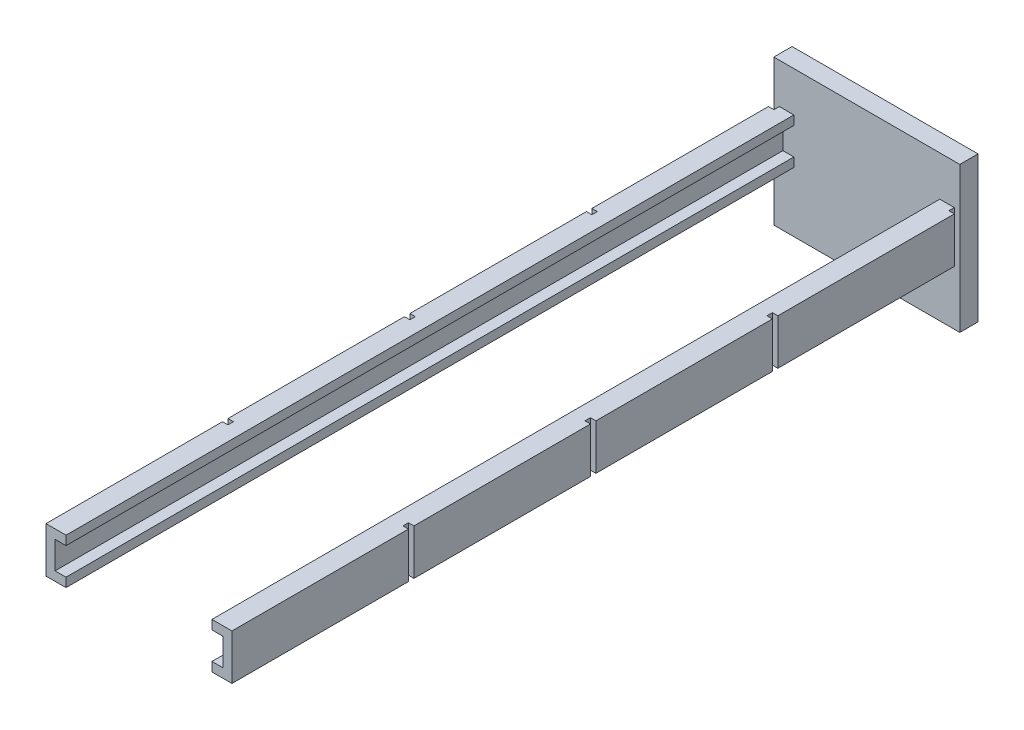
SolidWorks part; units mm, degrees
ref_plane "Plan de face" through (0, 0, 0) normal (0, 0, 1) x (1, 0, 0)
ref_plane "Plan de dessus" through (0, 0, 0) normal (0, 1, 0) x (1, 0, 0)
ref_plane "Plan de droite" through (0, 0, 0) normal (1, 0, 0) x (0, 0, -1)
sketch "Esquisse1" plane through (0, 0, 0) normal (0, 0, 1) x (1, 0, 0)
  line L0 (-40.1, -7.5) -> (-40.1, -12.5)
  line L1 (-40.1, 12.5) -> (-51.1, 12.5)
  line L2 (-40.1, 12.5) -> (-40.1, 7.5)
  line L3 (-40.1, -12.5) -> (-51.1, -12.5)
  line L4 (-51.1, 12.5) -> (-51.1, -12.5)
  line L5 (-40.1, -7.5) -> (-46.1, -7.5)
  line L6 (0, 0) -> (0, 26.5294) construction
  line L7 (-40.1, 7.5) -> (-46.1, 7.5)
  line L8 (-46.1, -7.5) -> (-46.1, 7.5)
  line L9 (51.1, 12.5) -> (51.1, -12.5)
  line L10 (40.1, 12.5) -> (51.1, 12.5)
  line L11 (40.1, 12.5) -> (40.1, 7.5)
  line L12 (40.1, 7.5) -> (46.1, 7.5)
  line L13 (46.1, -7.5) -> (46.1, 7.5)
  line L14 (40.1, -7.5) -> (46.1, -7.5)
  line L15 (40.1, -7.5) -> (40.1, -12.5)
  line L16 (40.1, -12.5) -> (51.1, -12.5)
  dimension "D1" = 6
  dimension "D2" = 15
  dimension "D3" = 5
  dimension "D4" = 5
  dimension "D5" = 5
  dimension "D6" = 7.5
  dimension "D7" = 40.1
extrude "Boss.-Extru.1" add sketch "Esquisse1" along normal blind 400
sketch "Esquisse2" plane through (0, 0, 0) normal (0, 0, -1) x (-1, 0, 0)
  line L0 (51.1, 12.5) -> (51.1, -12.5) construction
  line L1 (-51.1, 34.5585) -> (51.1, 34.5585)
  line L2 (-51.1, 34.5585) -> (-51.1, -45.4415)
  line L3 (-51.1, -45.4415) -> (51.1, -45.4415)
  line L4 (51.1, 34.5585) -> (51.1, -45.4415)
  line L5 (-51.1, -12.5) -> (-51.1, 12.5) construction
  dimension "D1" = 80
extrude "Boss.-Extru.2" add sketch "Esquisse2" along normal blind 10
sketch "Esquisse3" plane through (51.1, 0, 0) normal (1, 0, 0) x (0, 0, -1)
  line L0 (-400, 12.5) -> (0, 12.5) construction
  line L1 (0, -12.5) -> (-2.9913, -12.5)
  line L2 (0, -12.5) -> (0, 12.5)
  line L3 (0, 12.5) -> (-2.9913, 12.5)
  line L4 (-2.9913, -12.5) -> (-2.9913, 12.5)
extrude "Enlèv. mat.-Extru.1" cut sketch "Esquisse3" against normal blind 3
pattern_linear "Répétition linéaire1" count 4 spacing 100 along (0, 0, 1) of "Enlèv. mat.-Extru.1"
mirror "Symétrie1" about plane through (0, 0, 0) normal (1, 0, 0) of "Répétition linéaire1", "Enlèv. mat.-Extru.1"
